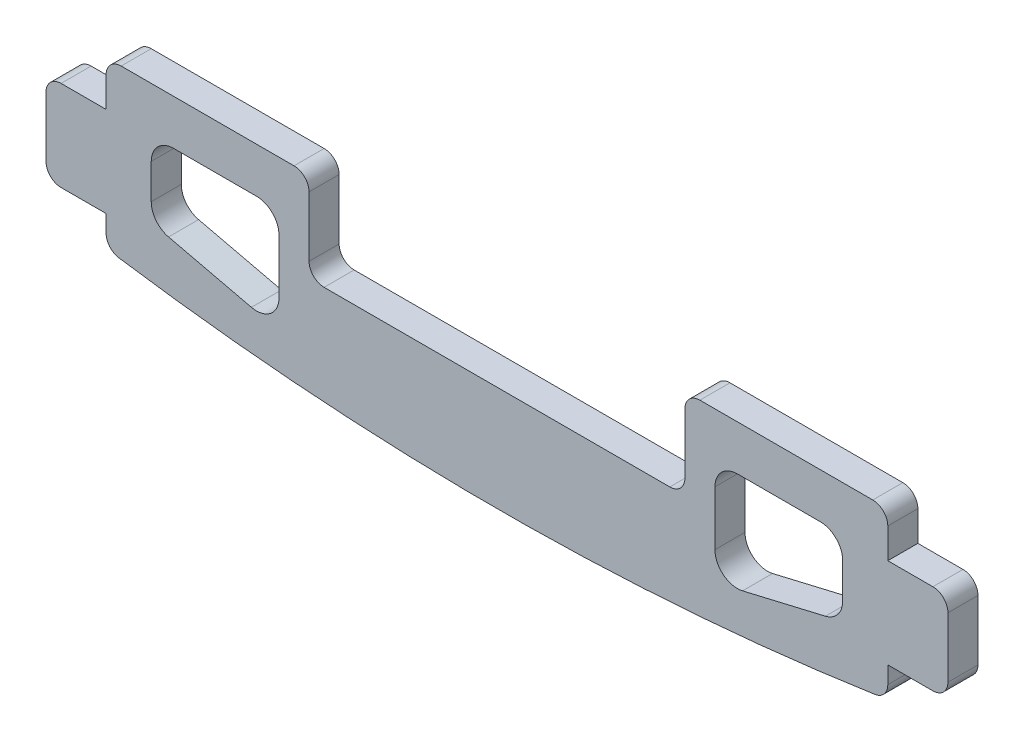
SolidWorks part; units mm, degrees
ref_plane "Plano frontal" through (0, 0, 0) normal (0, 0, 1) x (1, 0, 0)
ref_plane "Plano superior" through (0, 0, 0) normal (0, 1, 0) x (1, 0, 0)
ref_plane "Plano direito" through (0, 0, 0) normal (1, 0, 0) x (0, 0, -1)
sketch "Esboço1" plane through (0, 0, 0) normal (0, 0, 1) x (1, 0, 0)
  line L0 (-11.5, 0) -> (11.5, 0)
  line L1 (12.5, 1) -> (12.5, 5)
  line L2 (13.5, 6) -> (25, 6)
  line L3 (26, 5) -> (26, 3)
  line L4 (26, 3) -> (29, 3)
  line L5 (30, 2) -> (30, -2)
  line L6 (29, -3) -> (26, -3)
  line L7 (26, -3) -> (26, -4.1407)
  line L8 (0, 0) -> (0, -13.351) construction
  line L9 (15.994, 3) -> (21.506, 3)
  line L10 (23, 1.506) -> (23, -0.8167)
  line L11 (21.8482, -2.271) -> (16.3362, -3.5679)
  line L12 (14.5, -2.1136) -> (14.5, 1.506)
  line L13 (-14.5, -2.1136) -> (-14.5, 1.506)
  line L14 (-21.8482, -2.271) -> (-16.3362, -3.5679)
  line L15 (-23, 1.506) -> (-23, -0.8167)
  line L16 (-15.994, 3) -> (-21.506, 3)
  line L17 (-26, -3) -> (-26, -4.1407)
  line L18 (-29, -3) -> (-26, -3)
  line L19 (-30, 2) -> (-30, -2)
  line L20 (-26, 3) -> (-29, 3)
  line L21 (-26, 5) -> (-26, 3)
  line L22 (-13.5, 6) -> (-25, 6)
  line L23 (-12.5, 1) -> (-12.5, 5)
  arc A0 (25.1479, -5.1297) -> (0, -7) centre (0, 163) cw
  arc A1 (26, -4.1407) -> (25.1479, -5.1297) centre (25, -4.1407) cw
  arc A2 (30, -2) -> (29, -3) centre (29, -2) cw
  arc A3 (29, 3) -> (30, 2) centre (29, 2) cw
  arc A4 (25, 6) -> (26, 5) centre (25, 5) cw
  arc A5 (12.5, 5) -> (13.5, 6) centre (13.5, 5) cw
  arc A6 (11.5, 0) -> (12.5, 1) centre (11.5, 1) ccw
  arc A7 (21.506, 3) -> (23, 1.506) centre (21.506, 1.506) cw
  arc A8 (23, -0.8167) -> (21.8482, -2.271) centre (21.506, -0.8167) cw
  arc A9 (15.994, 3) -> (14.5, 1.506) centre (15.994, 1.506) ccw
  arc A10 (16.3362, -3.5679) -> (14.5, -2.1136) centre (15.994, -2.1136) cw
  arc A11 (-16.3362, -3.5679) -> (-14.5, -2.1136) centre (-15.994, -2.1136) ccw
  arc A12 (-15.994, 3) -> (-14.5, 1.506) centre (-15.994, 1.506) cw
  arc A13 (-23, -0.8167) -> (-21.8482, -2.271) centre (-21.506, -0.8167) ccw
  arc A14 (-21.506, 3) -> (-23, 1.506) centre (-21.506, 1.506) ccw
  arc A15 (-11.5, 0) -> (-12.5, 1) centre (-11.5, 1) cw
  arc A16 (-12.5, 5) -> (-13.5, 6) centre (-13.5, 5) ccw
  arc A17 (-25, 6) -> (-26, 5) centre (-25, 5) ccw
  arc A18 (-29, 3) -> (-30, 2) centre (-29, 2) ccw
  arc A19 (-30, -2) -> (-29, -3) centre (-29, -2) ccw
  arc A20 (-26, -4.1407) -> (-25.1479, -5.1297) centre (-25, -4.1407) ccw
  arc A21 (-25.1479, -5.1297) -> (0, -7) centre (0, 163) ccw
  point P15 (26, -5)
  point P34 (23, -2)
  point P39 (14.5, -4)
  point P73 (-14.5, -4)
  point P74 (-23, -2)
  point P75 (-26, -5)
  dimension "D9" = 1
  dimension "D15" = 1.494
  dimension "D1" = 12.5
  dimension "D2" = 26
  dimension "D3" = 30
  dimension "D4" = 6
  dimension "D5" = 3
  dimension "D6" = 6
  dimension "D7" = 11
  dimension "D8" = 7
  dimension "D10" = 2
  dimension "D11" = 3
  dimension "D12" = 3
  dimension "D13" = 4
  dimension "D14" = 2
extrude "Ressalto-extrusão1" add sketch "Esboço1" along normal blind 2
